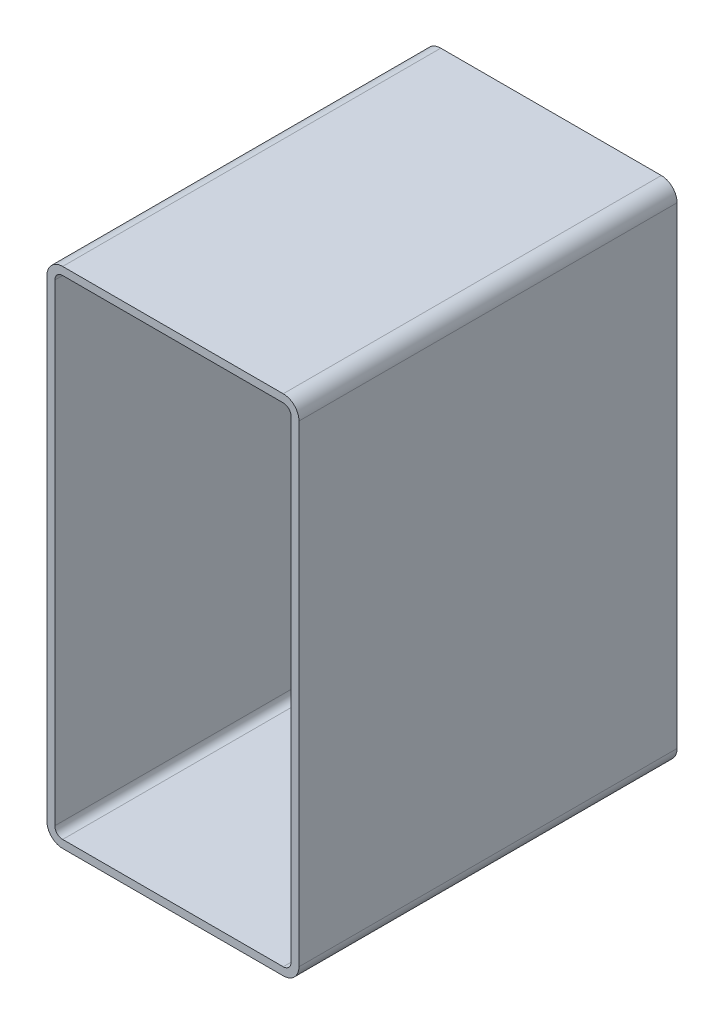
SolidWorks part; units mm, degrees
ref_plane "Front Plane" through (0, 0, 0) normal (0, 0, 1) x (1, 0, 0)
ref_plane "Top Plane" through (0, 0, 0) normal (0, 1, 0) x (1, 0, 0)
ref_plane "Right Plane" through (0, 0, 0) normal (1, 0, 0) x (0, 0, -1)
sketch "Sketch1" plane through (0, 0, 0) normal (0, 0, 1) x (1, 0, 0)
sketch_block_instance "HSS16x8x0.250-1"
sketch_block "HSS16x8x0.250"
extrude "Boss-Extrude1" add sketch "Sketch1" along normal blind 304.8
